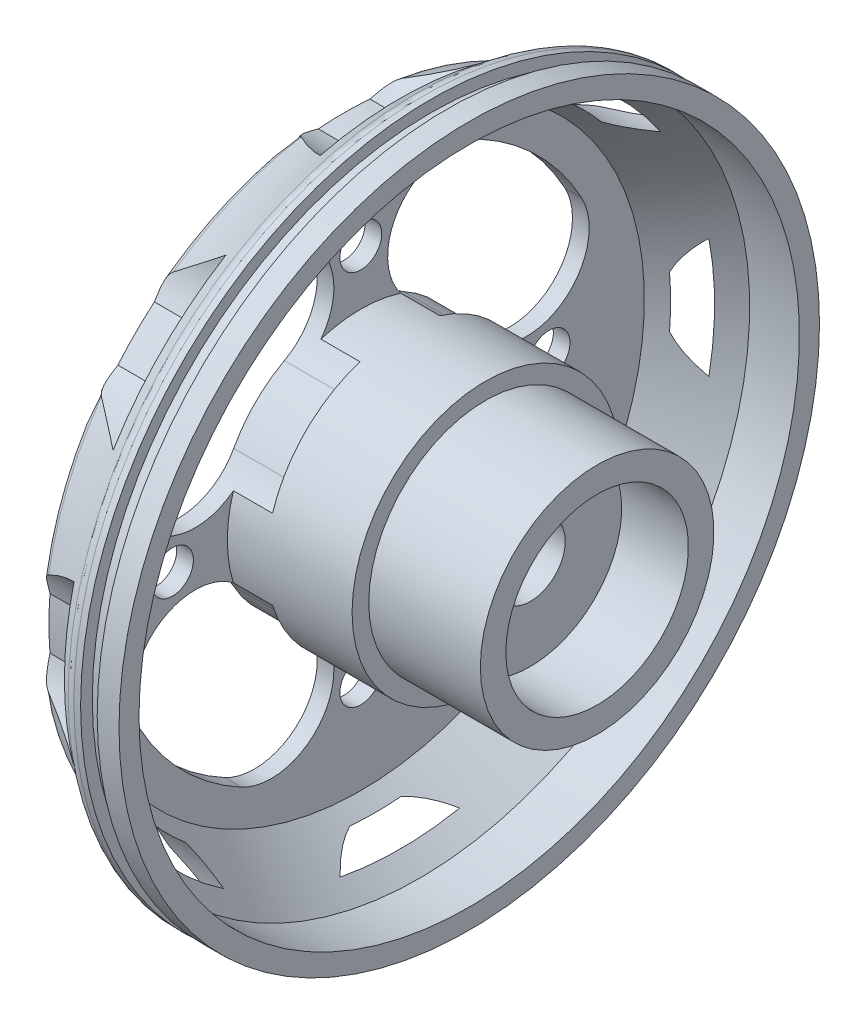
SolidWorks part; units mm, degrees
ref_plane "Front Plane" through (0, 0, 0) normal (0, 0, 1) x (1, 0, 0)
ref_plane "Top Plane" through (0, 0, 0) normal (0, 1, 0) x (1, 0, 0)
ref_plane "Right Plane" through (0, 0, 0) normal (1, 0, 0) x (0, 0, -1)
sketch "Sketch1" plane through (0, 0, 0) normal (0, 0, 1) x (1, 0, 0)
  line L0 (0, 30.9048) -> (0, 0) construction
  line L1 (0, 0) -> (41.2543, 0) construction
  line L3 (13.355, 6.545) -> (13.355, 2.5)
  line L4 (13.355, 2.5) -> (4.784, 2.5)
  line L5 (4.784, 2.5) -> (4.784, 6.545)
  line L6 (4.784, 6.545) -> (0, 6.545)
  line L7 (0, 6.545) -> (0, 21.815)
  line L8 (5.382, 25.11) -> (6.2192, 25.11)
  line L10 (1.196, 20.332) -> (1.196, 9.568)
  line L11 (1.196, 9.568) -> (10.139, 9.568)
  line L12 (10.139, 9.568) -> (10.139, 8.372)
  line L17 (18.139, 6.545) -> (13.355, 6.545)
  line L18 (10.139, 8.372) -> (18.139, 8.372)
  line L19 (18.139, 8.372) -> (18.139, 6.545)
  line L20 (8.97, 25.11) -> (8.97, 23.6748)
  line L21 (8.97, 23.6748) -> (5.4, 23.6748)
  line L23 (1.196, 20.332) -> (5.4, 23.6748)
  line L24 (7.4092, 25.11) -> (8.97, 25.11)
  line L26 (6.2192, 25.11) -> (6.2192, 24.2728)
  line L27 (6.2192, 24.2728) -> (7.4092, 24.2728)
  line L28 (7.4092, 25.11) -> (7.4092, 24.2728)
  arc A0 (5.382, 25.11) -> (0, 21.815) centre (-8.5797, 41.8721) cw
  point P3 (1.196, 14.95)
  dimension "D12" = 5.382
  dimension "D18" = 21.815
  dimension "D19" = 21.815
  dimension "D1" = 22.61
  dimension "D2" = 5.355
  dimension "D3" = 2.5
  dimension "D4" = 9.568
  dimension "D5" = 4.784
  dimension "D6" = 8.372
  dimension "D7" = 4.784
  dimension "D8" = 6.545
  dimension "D9" = 1.4352
  dimension "D10" = 3.588
  dimension "D11" = 1.196
  dimension "D13" = 10.764
  dimension "D14" = 3.57
  dimension "D15" = 1.19
  dimension "D16" = 0.8372
  dimension "D17" = 0.8372
  dimension "D20" = 8
revolve "Revolve1" add sketch "Sketch1" angle 360 about L1
fillet "Fillet1" radius 1 2 edges at (5.382, 0, 25.11) (0, 0, 21.815)
sketch "Sketch2" plane through (0, 0, 0) normal (-1, 0, 0) x (0, 0, 1)
  line L0 (0, 24.8885) -> (0, 0) construction
  line L1 (0, 0) -> (24.8885, 0) construction
  line L2 (0, 0) -> (17.5988, 17.5988) construction
  circle A0 centre (0, 0) radius 24.8885 construction
  arc A1 (6.4272, 11.8719) -> (11.8719, 6.4272) centre (0, 0) cw construction
  arc A2 (15.8292, 8.5695) -> (8.5695, 15.8292) centre (0, 0) ccw
  arc A3 (7.9146, 4.2848) -> (4.2848, 7.9146) centre (0, 0) ccw
  arc A4 (7.9146, 4.2848) -> (15.8292, 8.5695) centre (11.8719, 6.4272) ccw
  arc A5 (8.5695, 15.8292) -> (4.2848, 7.9146) centre (6.4272, 11.8719) ccw
  arc A6 (11.8719, -6.4272) -> (6.4272, -11.8719) centre (0, 0) cw construction
  arc A7 (8.5695, -15.8292) -> (15.8292, -8.5695) centre (0, 0) ccw
  arc A8 (4.2848, -7.9146) -> (7.9146, -4.2848) centre (0, 0) ccw
  arc A9 (4.2848, -7.9146) -> (8.5695, -15.8292) centre (6.4272, -11.8719) ccw
  arc A10 (15.8292, -8.5695) -> (7.9146, -4.2848) centre (11.8719, -6.4272) ccw
  arc A11 (-6.4272, -11.8719) -> (-11.8719, -6.4272) centre (0, 0) cw construction
  arc A12 (-15.8292, -8.5695) -> (-8.5695, -15.8292) centre (0, 0) ccw
  arc A13 (-7.9146, -4.2848) -> (-4.2848, -7.9146) centre (0, 0) ccw
  arc A14 (-7.9146, -4.2848) -> (-15.8292, -8.5695) centre (-11.8719, -6.4272) ccw
  arc A15 (-8.5695, -15.8292) -> (-4.2848, -7.9146) centre (-6.4272, -11.8719) ccw
  arc A16 (-11.8719, 6.4272) -> (-6.4272, 11.8719) centre (0, 0) cw construction
  arc A17 (-8.5695, 15.8292) -> (-15.8292, 8.5695) centre (0, 0) ccw
  arc A18 (-4.2848, 7.9146) -> (-7.9146, 4.2848) centre (0, 0) ccw
  arc A19 (-4.2848, 7.9146) -> (-8.5695, 15.8292) centre (-6.4272, 11.8719) ccw
  arc A20 (-15.8292, 8.5695) -> (-7.9146, 4.2848) centre (-11.8719, 6.4272) ccw
  arc A21 (12.6074, 21.7156) -> (21.7156, 12.6074) centre (20.2595, 20.2595) ccw
  circle A22 centre (0, 0) radius 25.11 construction
  arc A23 (24.27, 6.4405) -> (24.27, -6.4405) centre (28.6513, 0) ccw
  arc A24 (21.7156, -12.6074) -> (12.6074, -21.7156) centre (20.2595, -20.2595) ccw
  arc A25 (6.4405, -24.27) -> (-6.4405, -24.27) centre (0, -28.6513) ccw
  arc A26 (-12.6074, -21.7156) -> (-21.7156, -12.6074) centre (-20.2595, -20.2595) ccw
  arc A27 (-24.27, -6.4405) -> (-24.27, 6.4405) centre (-28.6513, 0) ccw
  arc A28 (-21.7156, 12.6074) -> (-12.6074, 21.7156) centre (-20.2595, 20.2595) ccw
  arc A29 (-6.4405, 24.27) -> (6.4405, 24.27) centre (0, 28.6513) ccw
  circle A30 centre (0, 0) radius 25.11
  point P10 (9.5459, 9.5459)
  point P20 (9.5459, -9.5459)
  point P27 (-9.5459, -9.5459)
  point P34 (-9.5459, 9.5459)
  point P39 (0, 0)
  point P67 (0, 0)
  dimension "D2" = 9
  dimension "D3" = 18
  dimension "D1" = 7.7
  dimension "D4" = 4
  dimension "D5" = 8
extrude "Cut-Extrude2" cut sketch "Sketch2" against normal blind 4 contours A28 A30 M14 | A29 A30 M14 | A21 A30 M14 | A23 A30 M14 | A24 A30 M14 | A25 A30 M14 | A26 A30 M14 | A27 A30 M14 | A17 A20 A18 A19 | A2 A5 A3 A4 | A7 A10 A8 A9 | A12 A15 A13 A14
sketch "Sketch3" plane through (0, 0, 0) normal (-1, 0, 0) x (0, 0, 1)
  circle A0 centre (0, 0) radius 13.5 construction
  circle A1 centre (0, 13.5) radius 1.5
  circle A2 centre (13.5, 0) radius 1.5
  circle A3 centre (0, -13.5) radius 1.5
  circle A4 centre (-13.5, 0) radius 1.5
  point P15 (0, 0)
  dimension "D2" = 3
  dimension "D1" = 4
extrude "Cut-Extrude3" cut sketch "Sketch3" against normal blind 4
